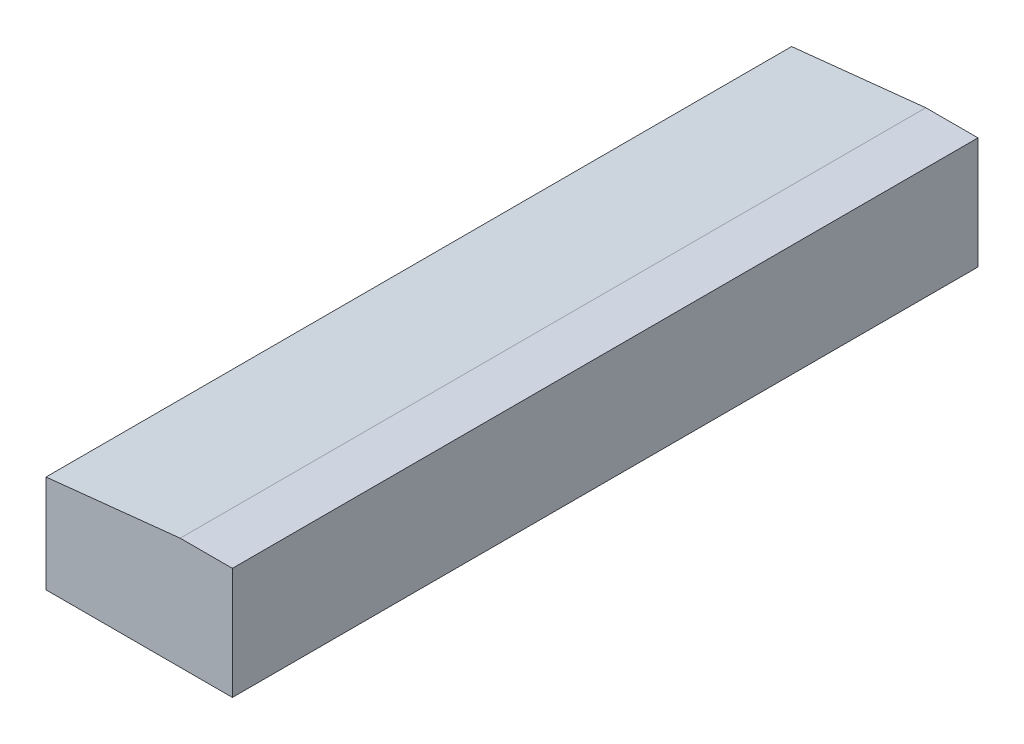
SolidWorks part; units mm, degrees
ref_plane "Plan de face" through (0, 0, 0) normal (0, 0, 1) x (1, 0, 0)
ref_plane "Plan de dessus" through (0, 0, 0) normal (0, 1, 0) x (1, 0, 0)
ref_plane "Plan de droite" through (0, 0, 0) normal (1, 0, 0) x (0, 0, -1)
sketch "Esquisse1" plane through (0, 0, 0) normal (0, 0, 1) x (1, 0, 0)
  line L0 (-7.0556, 0) -> (61.1481, 0) construction
  line L1 (0, 21.637) -> (0, -13.4056) construction
  line L2 (25, -13.4056) -> (25, 27.7519) construction
  line L3 (61.1481, 15) -> (-8.937, 15) construction
  line L5 (18, 16.9984) -> (18, 13.5649) construction
  line L6 (0, 13.1081) -> (18, 15)
  line L7 (18, 15) -> (25, 15)
  line L8 (25, 15) -> (25, 0)
  line L9 (25, 0) -> (0, 0)
  line L10 (0, 0) -> (0, 13.1081)
  dimension "D1" = 25
  dimension "D2" = 15
  dimension "D3" = 7
  dimension "D4" = 6
extrude "Extrusion1" add sketch "Esquisse1" along normal blind 100
